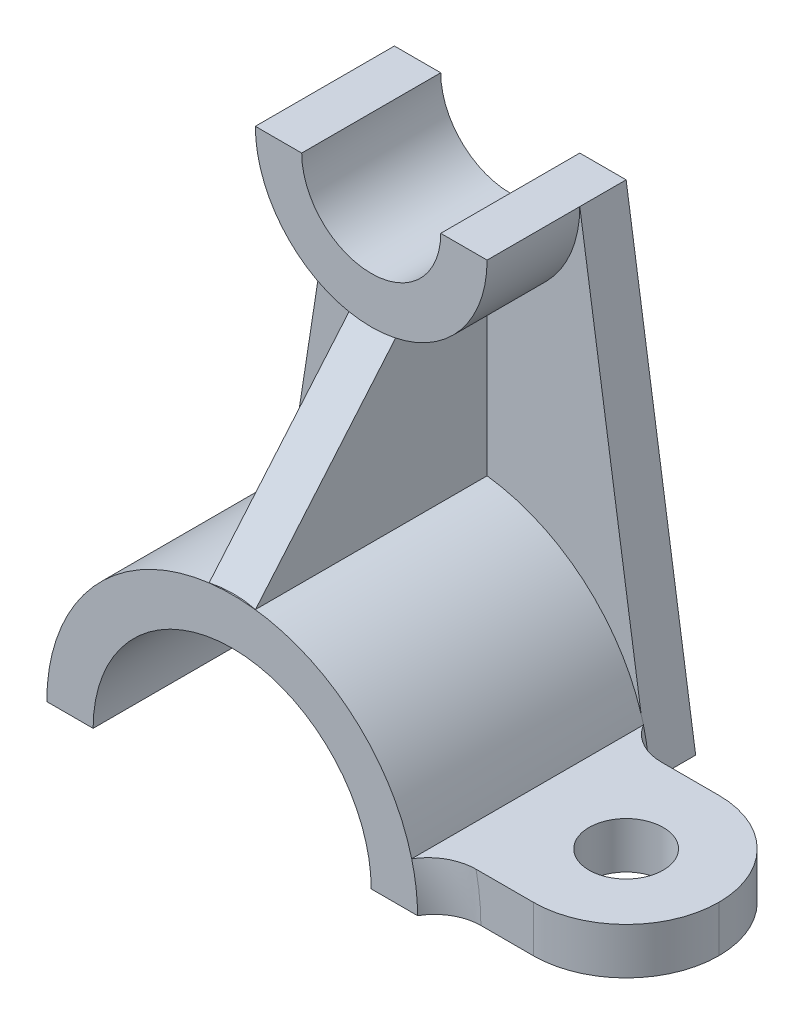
SolidWorks part; units mm, degrees
ref_plane "Plane1" through (0, 0, 0) normal (0, 0, 1) x (1, 0, 0)
ref_plane "Plane2" through (0, 0, 0) normal (0, 1, 0) x (1, 0, 0)
ref_plane "Plane3" through (0, 0, 0) normal (1, 0, 0) x (0, 0, -1)
sketch "Sketch1" plane through (0, 0, 0) normal (0, 0, 1) x (1, 0, 0)
  line L0 (30, 0) -> (40, 0)
  line L1 (-40, 0) -> (-30, 0)
  arc A0 (30, 0) -> (-30, 0) centre (0, 0) ccw
  arc A1 (40, 0) -> (-40, 0) centre (0, 0) ccw
  dimension "D1" = 30
  dimension "D3" = 40
  dimension "D2" = 10
  dimension "D4" = 10
extrude "Base-Extrude" add sketch "Sketch1" along normal blind 50
ref_plane "Plane4" through (0, 0, 25) normal (0, 0, 1) x (1, 0, 0)
sketch "Sketch3" plane through (0, 0, 25) normal (0, 0, 1) x (1, 0, 0)
  line L0 (40, 0) -> (80, 0)
  line L1 (80, 0) -> (80, 10)
  line L2 (80, 10) -> (38.7298, 10)
  arc A0 (40, 0) -> (-40, 0) centre (0, 0) ccw construction
  arc A1 (40, 0) -> (38.7298, 10) centre (0, 0) ccw
  dimension "D1" = 80
  dimension "D2" = 10
extrude "Boss-Extrude2" add sketch "Sketch3" along normal mid plane 40
fillet "Fillet1" radius 20 4 edges at (80, 5, 5) (80, 0, 25) (80, 10, 25) (80, 5, 45)
fillet "Fillet2" radius 10 4 edges at (40, 0, 2.5) (39.6812, 5.0402, 5) (39.6812, 5.0402, 45) (40, 0, 47.5)
sketch "Sketch4" plane through (0, 10, 0) normal (0, 1, 0) x (-1, 0, 0)
  circle A0 centre (-60, 25) radius 8
  dimension "D1" = 16
extrude "Cut-Extrude1" cut sketch "Sketch4" against normal through all
sketch "Sketch5" plane through (0, 0, 0) normal (0, 0, 1) x (1, 0, 0)
  line L0 (40, 0) -> (25, 100)
  line L1 (-40.4652, 0.0709) -> (-25, 100)
  line L2 (-40.4652, 0.0709) -> (40, 0)
  arc A0 (25, 100) -> (-25, 100) centre (0, 100) cw
  arc A1 (38.7298, 10) -> (-40, 0) centre (0, 0) ccw construction
  dimension "D2" = 25
  dimension "D1" = 100
extrude "Boss-Extrude4" add sketch "Sketch5" against normal blind 10
sketch "Sketch6" plane through (0, 0, -10) normal (0, 0, -1) x (-1, 0, 0)
  line L0 (15, 100) -> (25, 100)
  line L1 (-15, 100) -> (-25, 100)
  arc A0 (-25, 100) -> (25, 100) centre (0, 100) ccw construction
  arc A1 (-25, 100) -> (25, 100) centre (0, 100) ccw
  arc A2 (15, 100) -> (-15, 100) centre (0, 100) cw
  dimension "D1" = 10
extrude "Boss-Extrude5" add sketch "Sketch6" against normal blind 30
sketch "Sketch8" plane through (0, 0, 0) normal (1, 0, 0) x (0, 0, -1)
  line L0 (-20, 75) -> (-49.7, 40)
  line L5 (-20, 75) -> (0, 75) construction
  line L9 (0, 40) -> (-50, 40) construction
  line L10 (-50, 40) -> (-50, 0) construction
  dimension "D1" = 0.3
rib "Rib12" sketch "Sketch8" sketch "Sketch8" thickness 10 extrusion direction parallel to sketch draft on no parameters "D1"=10
